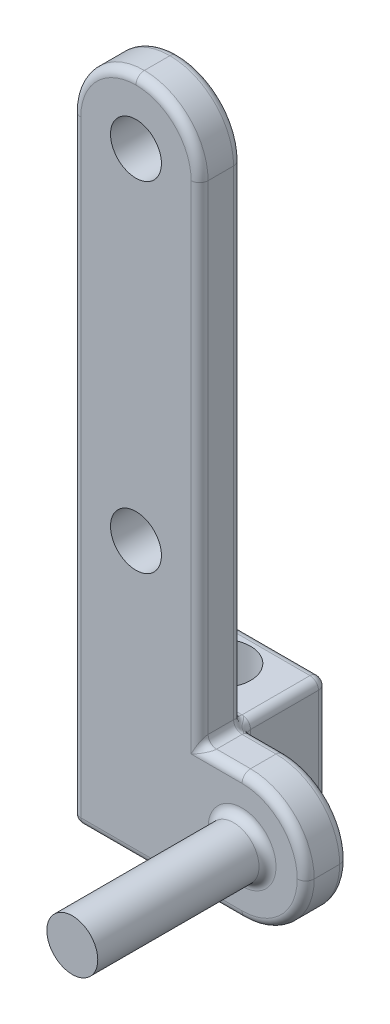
SolidWorks part; units mm, degrees
ref_plane "Plan de face" through (0, 0, 0) normal (0, 0, 1) x (1, 0, 0)
ref_plane "Plan de dessus" through (0, 0, 0) normal (0, 1, 0) x (1, 0, 0)
ref_plane "Plan de droite" through (0, 0, 0) normal (1, 0, 0) x (0, 0, -1)
sketch "Esquisse1" plane through (0, 0, 0) normal (0, 0, 1) x (1, 0, 0)
  line L0 (25, -160) -> (-30, -160)
  line L1 (0, 0) -> (0, -130)
  line L2 (0, 0) -> (-30, 0)
  line L3 (-30, 0) -> (-30, -160)
  line L4 (0, -130) -> (25, -130)
  line L5 (25, -160) -> (25, -130)
  dimension "D5" = 25
  dimension "D1" = 160
  dimension "D2" = 130
  dimension "D3" = 55
  dimension "D4" = 30
extrude "Extrusion1" add sketch "Esquisse1" along normal blind 10
sketch "Esquisse2" plane through (0, 0, 10) normal (0, 0, 1) x (1, 0, 0)
  circle A0 centre (10, -145) radius 6
  dimension "D1" = 12
  dimension "D3" = 15
  dimension "D2" = 15
extrude "Extrusion2" add sketch "Esquisse2" along normal blind 40
sketch "Esquisse3" plane through (0, 0, 0) normal (0, 0, -1) x (-1, 0, 0)
  line L0 (0, -130) -> (0, -160)
  line L1 (-25, -130) -> (0, -130) construction
  line L2 (0, -130) -> (0, 0) construction
  line L3 (30, -160) -> (-25, -160) construction
  line L4 (0, -160) -> (30, -160)
  line L5 (30, -160) -> (30, -130)
  line L6 (30, 0) -> (30, -160) construction
  line L7 (30, -130) -> (0, -130)
  dimension "D1" = 30
  dimension "D2" = 30
extrude "Extrusion3" add sketch "Esquisse3" along normal blind 20
sketch "Esquisse5" plane through (0, 0, 10) normal (0, 0, 1) x (1, 0, 0)
  line L2 (0, -130) -> (0, 0) construction
  circle A0 centre (-15, -15) radius 6
  circle A1 centre (-15, -95) radius 6
  dimension "D1" = 12
  dimension "D2" = 15
  dimension "D3" = 15
  dimension "D4" = 80
  dimension "D5" = 15
extrude "Enlèv. mat.-Extru.2" cut sketch "Esquisse5" against normal through all
fillet "Congé1" radius 15 4 edges at (25, -160, 5) (25, -130, 5) (-30, 0, 5) (0, 0, 5)
fillet "Congé8" radius 2 5 edges at (-15, -160, -20) (-30, -145, -20) (-15, -130, -20) (0, -145, -20)
fillet "Congé9" radius 2 10 edges at (-0.5858, -159.4142, -19.4142) (0.5858, -160, -0.5858) (20.6066, -155.6066, 0) (20.6066, -134.3934, 0) (-0.5858, -130.5858, -19.4142) (0, -130, -10) (0.5858, -130, -0.5858) (6, -130, 0)
fillet "Congé11" radius 2 9 edges at (5, -130, 10) (-25.6066, -4.3934, 10) (-4.3934, -4.3934, 10) (4, -145, 10) (-30, -87.5, 10) (-10, -160, 10) (20.6066, -134.3934, 10) (20.6066, -155.6066, 10) (0, -72.5, 10)
fillet "Congé12" radius 2 12 edges at (-29.4142, -130.5858, -19.4142) (0, -72.6895, 0) (-4.3934, -4.3934, 0) (-25.6066, -4.3934, 0) (-29.4142, -159.4142, 9.4142) (-29.4142, -159.4142, -19.4142) (-30, -160, -5) (-0.5858, -130.5858, 9.4142) (0, -130, 4.7321)
hole_wizard "Trou taraudé M161" positions "Esquisse13" profile "Esquisse12" tap size "M16" standard "ISO"
sketch "Esquisse13" plane through (0, -160, 0) normal (0, -1, 0) x (1, 0, 0)
  line L0 (0, -2) -> (0, -18) construction
  line L1 (-28, 10) -> (10, 10) construction
  point P0 (-15, -10)
  point P2 (0, -10)
  dimension "D1" = 15
  dimension "D2" = 20
sketch "Esquisse12" plane through (-15, -160, -10) normal (1, 0, 0) x (0, 0, -1)
  line L0 (0, 0) -> (0, 42.206)
  line L1 (0, 42.206) -> (7, 38)
  line L2 (7, 38) -> (7, 0)
  line L5 (7, 0) -> (0, 0)
  line L10 (0, 42.206) -> (-7, 38) construction
  line L11 (0, -6.35) -> (0, 107.95) construction
  dimension "Diamètre du trou pour taraudage" = 14
  dimension "Profondeur du trou pour taraudage" = 38
  dimension "Angle de pointe" = 118
